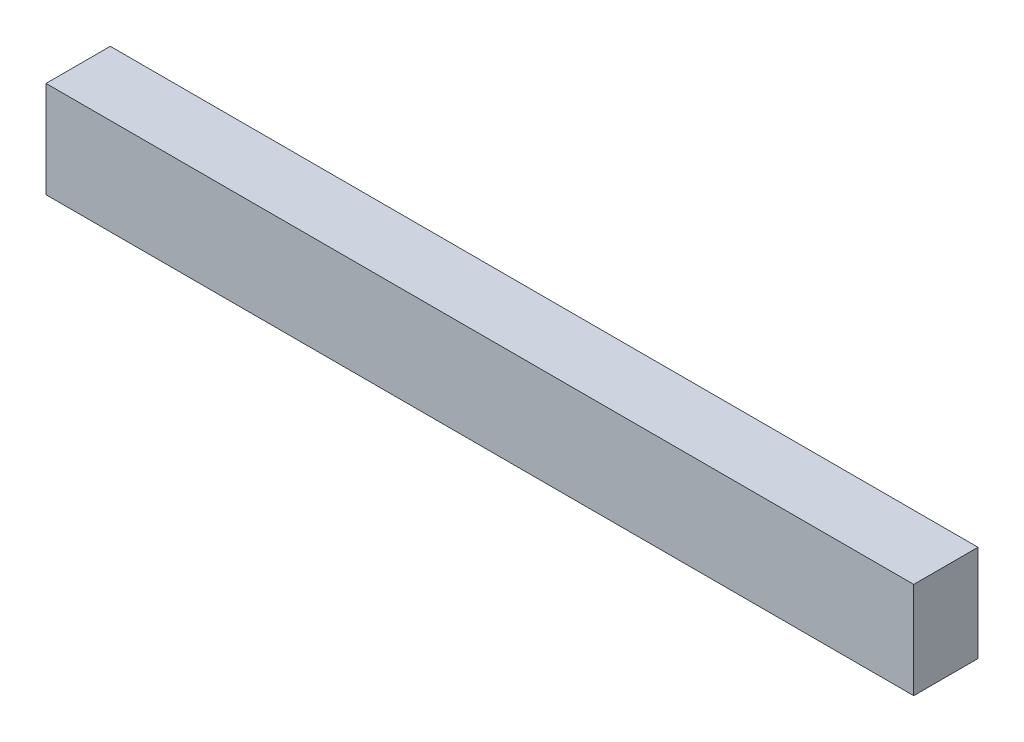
SolidWorks part; units mm, degrees
ref_plane "Plan de face" through (0, 0, 0) normal (0, 0, 1) x (1, 0, 0)
ref_plane "Plan de dessus" through (0, 0, 0) normal (0, 1, 0) x (1, 0, 0)
ref_plane "Plan de droite" through (0, 0, 0) normal (1, 0, 0) x (0, 0, -1)
sketch "Esquisse1" plane through (0, 0, 0) normal (1, 0, 0) x (0, 0, -1)
  line L1 (0, 0) -> (20, 0)
  line L2 (0, 0) -> (0, 30)
  line L3 (0, 30) -> (20, 30)
  line L4 (20, 0) -> (20, 30)
extrude "Extrusion1" add sketch "Esquisse1" along normal blind 270
